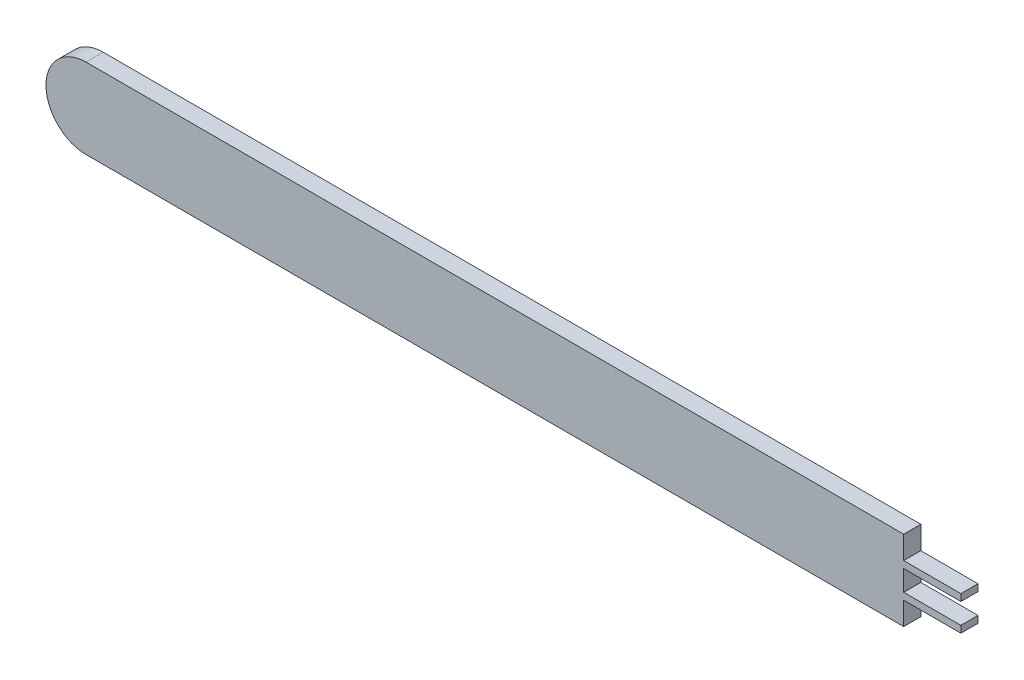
SolidWorks part; units mm, degrees
ref_plane "Plan de face" through (0, 0, 0) normal (0, 0, 1) x (1, 0, 0)
ref_plane "Plan de dessus" through (0, 0, 0) normal (0, 1, 0) x (1, 0, 0)
ref_plane "Plan de droite" through (0, 0, 0) normal (1, 0, 0) x (0, 0, -1)
sketch "Esquisse1" plane through (0, 0, 0) normal (0, 0, 1) x (1, 0, 0)
  line L0 (75, -2.6) -> (75, -4.4)
  line L1 (0, 0) -> (75, 0)
  line L2 (0, 0) -> (0, -7)
  line L3 (0, -7) -> (75, -7)
  line L4 (75, 0) -> (75, -2)
  line L5 (75, -2) -> (80, -2)
  line L7 (75, -2.6) -> (80, -2.6)
  line L8 (80, -2) -> (80, -2.6)
  line L9 (75, -4.4) -> (80, -4.4)
  line L11 (75, -5) -> (80, -5)
  line L12 (80, -4.4) -> (80, -5)
  line L13 (75, -5) -> (75, -7)
  dimension "D1" = 75
  dimension "D2" = 7
  dimension "D3" = 5
  dimension "D4" = 0.6
  dimension "D5" = 0.6
  dimension "D6" = 2
  dimension "D7" = 2
extrude "Boss.-Extru.1" add sketch "Esquisse1" along normal blind 1.5
fillet "Congé1" radius 3.5 2 edges at (0, 0, 0.75) (0, -7, 0.75)
